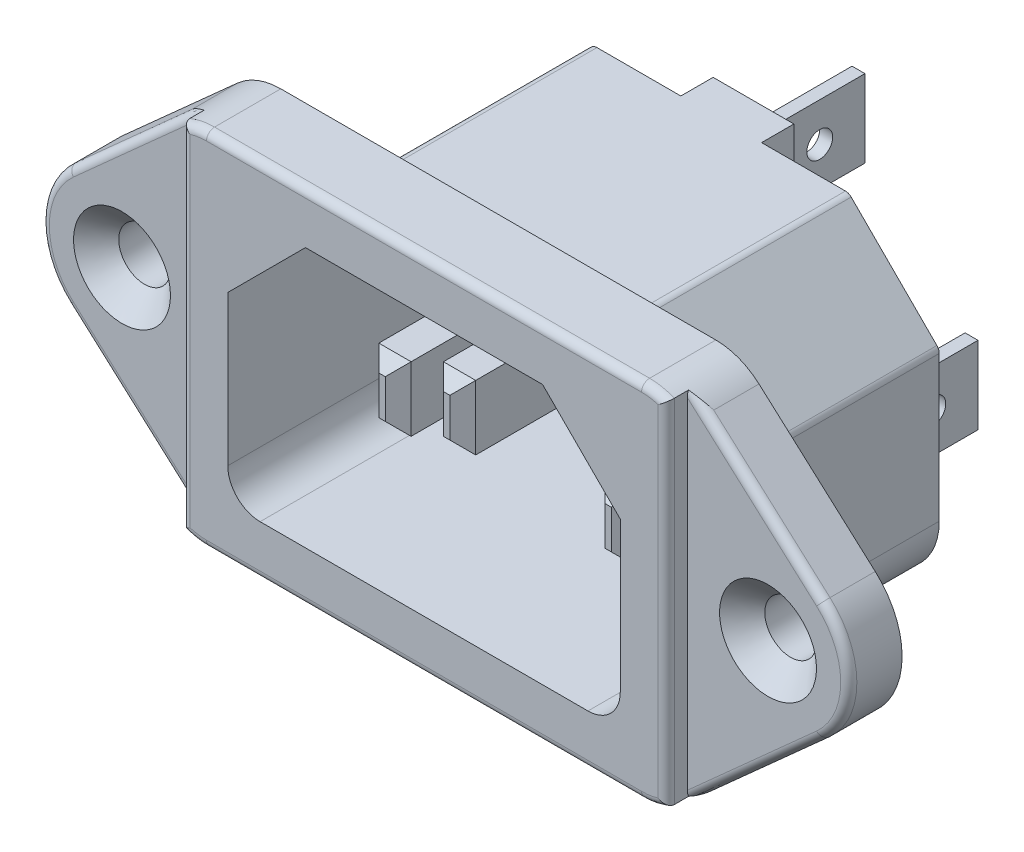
SolidWorks part; units mm, degrees
ref_plane "Front Plane" through (0, 0, 0) normal (0, 0, 1) x (1, 0, 0)
ref_plane "Top Plane" through (0, 0, 0) normal (0, 1, 0) x (1, 0, 0)
ref_plane "Right Plane" through (0, 0, 0) normal (1, 0, 0) x (0, 0, -1)
sketch "Sketch1" plane through (0, 0, 0) normal (0, 0, 1) x (1, 0, 0)
  line L0 (15, -11.2) -> (27.489, 0)
  line L1 (27.489, 0) -> (17.445, 11.2)
  line L2 (17.445, 11.2) -> (-15, 11.2)
  line L3 (-15, 11.2) -> (-27.489, 0)
  line L4 (-27.489, 0) -> (-15, -11.2)
  line L5 (-15, -11.2) -> (15, -11.2)
extrude "Boss-Extrude1" add sketch "Sketch1" against normal blind 3.3
sketch "Sketch2" plane through (0, 0, 0) normal (0, 0, 1) x (1, 0, 0)
  line L0 (15, -11.2) -> (-15, -11.2)
  line L1 (-15, -11.2) -> (-15, 11.2)
  line L2 (-15, 11.2) -> (15, 11.2)
  line L3 (15, 11.2) -> (15, -11.2)
extrude "Boss-Extrude2" add sketch "Sketch2" along normal blind 1.3
sketch "Sketch3" plane through (0, 0, -3.3) normal (0, 0, -1) x (-1, 0, 0)
  line L0 (7.9, 9.4) -> (13.5, 3.8)
  line L1 (13.5, 3.8) -> (13.5, -9.4)
  line L2 (13.5, -9.4) -> (-13.5, -9.4)
  line L3 (-13.5, -9.4) -> (-13.5, 3.8)
  line L4 (-13.5, 3.8) -> (-7.9, 9.4)
  line L5 (-7.9, 9.4) -> (7.9, 9.4)
extrude "Boss-Extrude3" add sketch "Sketch3" along normal blind 13.8
sketch "Sketch4" plane through (0, 0, 1.3) normal (0, 0, 1) x (1, 0, 0)
  line L0 (7.3408, 8.05) -> (-7.3408, 8.05)
  line L1 (-7.3408, 8.05) -> (-12.15, 3.2408)
  line L2 (-12.15, 3.2408) -> (-12.15, -8.05)
  line L3 (-12.15, -8.05) -> (12.15, -8.05)
  line L4 (12.15, -8.05) -> (12.15, 3.2408)
  line L5 (12.15, 3.2408) -> (7.3408, 8.05)
extrude "Cut-Extrude1" cut sketch "Sketch4" against normal blind 16.4
ref_plane "Plane1" through (0, 0, 0) normal (0, -1, 0) x (1, 0, 0)
sketch "Sketch5" plane through (0, 0, 0) normal (0, -1, 0) x (1, 0, 0)
  line L0 (-1, -15.1) -> (1, -15.1)
  line L1 (1, -15.1) -> (1, -0.9)
  line L2 (1, -0.9) -> (0, 0.1)
  line L3 (0, 0.1) -> (-1, -0.9)
  line L4 (-1, -0.9) -> (-1, -15.1)
extrude "Boss-Extrude4" add sketch "Sketch5" against normal blind 4 separate body
ref_plane "Plane2" through (0, -4, 0) normal (0, -1, 0) x (1, 0, 0)
sketch "Sketch6" plane through (0, -4, 0) normal (0, -1, 0) x (1, 0, 0)
  line L0 (-8, -15.1) -> (-6, -15.1)
  line L1 (-6, -15.1) -> (-6, -3.9)
  line L2 (-6, -3.9) -> (-7, -2.9)
  line L3 (-7, -2.9) -> (-8, -3.9)
  line L4 (-8, -3.9) -> (-8, -15.1)
extrude "Boss-Extrude5" add sketch "Sketch6" against normal blind 4 separate body
sketch "Sketch7" plane through (0, -4, 0) normal (0, -1, 0) x (1, 0, 0)
  line L0 (6, -15.1) -> (8, -15.1)
  line L1 (8, -15.1) -> (8, -3.9)
  line L2 (8, -3.9) -> (7, -2.9)
  line L3 (7, -2.9) -> (6, -3.9)
  line L4 (6, -3.9) -> (6, -15.1)
extrude "Boss-Extrude6" add sketch "Sketch7" against normal blind 4 separate body
sketch "Sketch8" plane through (0, 0, -17.1) normal (0, 0, -1) x (-1, 0, 0)
  line L0 (-2.5, 1.4) -> (-2.5, 9.4)
  line L1 (-2.5, 9.4) -> (2.5, 9.4)
  line L2 (2.5, 9.4) -> (2.5, 1.4)
  line L3 (2.5, 1.4) -> (-2.5, 1.4)
extrude "Boss-Extrude7" add sketch "Sketch8" along normal blind 2
sketch "Sketch9" plane through (0, 0, -19.1) normal (0, 0, -1) x (-1, 0, 0)
  line L0 (0.4, 3) -> (-0.4, 3)
  line L1 (-0.4, 3) -> (-0.4, 7.8)
  line L2 (-0.4, 7.8) -> (0.4, 7.8)
  line L3 (0.4, 7.8) -> (0.4, 3)
extrude "Boss-Extrude8" add sketch "Sketch9" along normal blind 6.5 separate body
sketch "Sketch10" plane through (0, 0, -17.1) normal (0, 0, -1) x (-1, 0, 0)
  line L0 (9.5, -1.4) -> (9.5, -9.4)
  line L1 (9.5, -9.4) -> (4.5, -9.4)
  line L2 (4.5, -9.4) -> (4.5, -1.4)
  line L3 (4.5, -1.4) -> (9.5, -1.4)
extrude "Boss-Extrude9" add sketch "Sketch10" along normal blind 2
sketch "Sketch11" plane through (0, 0, -19.1) normal (0, 0, -1) x (-1, 0, 0)
  line L0 (7.4, -7.8) -> (6.6, -7.8)
  line L1 (6.6, -7.8) -> (6.6, -3)
  line L2 (6.6, -3) -> (7.4, -3)
  line L3 (7.4, -3) -> (7.4, -7.8)
extrude "Boss-Extrude10" add sketch "Sketch11" along normal blind 6.5 separate body
sketch "Sketch12" plane through (0, 0, -17.1) normal (0, 0, -1) x (-1, 0, 0)
  line L0 (-4.5, -1.4) -> (-4.5, -9.4)
  line L1 (-4.5, -9.4) -> (-9.5, -9.4)
  line L2 (-9.5, -9.4) -> (-9.5, -1.4)
  line L3 (-9.5, -1.4) -> (-4.5, -1.4)
extrude "Boss-Extrude11" add sketch "Sketch12" along normal blind 2
sketch "Sketch13" plane through (0, 0, -19.1) normal (0, 0, -1) x (-1, 0, 0)
  line L0 (-6.6, -7.8) -> (-7.4, -7.8)
  line L1 (-7.4, -7.8) -> (-7.4, -3)
  line L2 (-7.4, -3) -> (-6.6, -3)
  line L3 (-6.6, -3) -> (-6.6, -7.8)
extrude "Boss-Extrude12" add sketch "Sketch13" along normal blind 6.5 separate body
draft "Draft1" type of draft neutral plane draft angle 6.229 faces to draft 1 parameters "D1"=6.229
hole_wizard "CSK for M3 Flat Head Machine Screw1" positions "Sketch15" profile "Sketch14" countersink size "M3" standard "ANSI Metric"
sketch "Sketch15" plane through (0, 0, 0) normal (0, 0, 1) x (1, 0, 0)
  point P0 (-20, 0)
  point P1 (20, 0)
sketch "Sketch14" plane through (-20, 0, 0) normal (1, 0, 0) x (0, -1, 0)
  line L0 (0, 0) -> (0, 25.6)
  line L1 (0, 25.6) -> (1.6, 25.6)
  line L2 (1.6, 25.6) -> (1.6, 1.4)
  line L3 (1.6, 1.4) -> (3, 0)
  line L5 (3, 0) -> (0, 0)
  line L6 (-1.6, 1.4) -> (-3, 0) construction
  line L11 (0, -6.35) -> (0, 107.95) construction
  dimension "Thru Hole Dia." = 3.2
  dimension "Thru Hole Depth" = 25.6
  dimension "Near C'Sink Dia." = 6
  dimension "Near C'Sink Angle" = 90
hole_wizard "Ø1.6 (1.6) Diameter Hole1" positions "Sketch17" profile "Sketch16" hole size "Ø1.6" standard "ANSI Metric"
sketch "Sketch17" plane through (7.4, 0, 0) normal (1, 0, 0) x (0, 0, -1)
  point P0 (22.8, -5.4)
sketch "Sketch16" plane through (7.4, -5.4, -22.8) normal (0, 1, 0) x (0, 0, -1)
  line L0 (0, 0) -> (0, 0.801)
  line L1 (0, 0.801) -> (0.8, 0.801)
  line L2 (0.8, 0.801) -> (0.8, 0)
  line L5 (0.8, 0) -> (0, 0)
  line L11 (0, -6.35) -> (0, 107.95) construction
  dimension "Thru Hole Dia." = 1.6
  dimension "Thru Hole Depth" = 0.801
hole_wizard "Ø1.6 (1.6) Diameter Hole2" positions "Sketch19" profile "Sketch18" hole size "Ø1.6" standard "ANSI Metric"
sketch "Sketch19" plane through (-6.6, 0, 0) normal (1, 0, 0) x (0, 0, -1)
  point P0 (22.8, -5.4)
sketch "Sketch18" plane through (-6.6, -5.4, -22.8) normal (0, 1, 0) x (0, 0, -1)
  line L0 (0, 0) -> (0, 20.889)
  line L1 (0, 20.889) -> (0.8, 20.889)
  line L2 (0.8, 20.889) -> (0.8, 0)
  line L5 (0.8, 0) -> (0, 0)
  line L11 (0, -6.35) -> (0, 107.95) construction
  dimension "Thru Hole Dia." = 1.6
  dimension "Thru Hole Depth" = 20.889
hole_wizard "Ø1.6 (1.6) Diameter Hole3" positions "Sketch21" profile "Sketch20" hole size "Ø1.6" standard "ANSI Metric"
sketch "Sketch21" plane through (-0.4, 0, 0) normal (-1, 0, 0) x (0, 0, 1)
  point P0 (-22.8, 5.4)
sketch "Sketch20" plane through (-0.4, 5.4, -22.8) normal (0, 1, 0) x (0, 0, 1)
  line L0 (0, 0) -> (0, 27.8891)
  line L1 (0, 27.8891) -> (0.8, 27.8891)
  line L2 (0.8, 27.8891) -> (0.8, 0)
  line L5 (0.8, 0) -> (0, 0)
  line L11 (0, -6.35) -> (0, 107.95) construction
  dimension "Thru Hole Dia." = 1.6
  dimension "Thru Hole Depth" = 27.8891
fillet "Fillet1" radius 4 6 edges at (-13.5, -9.4, -10.2) (13.5, -9.4, -10.2) (-15, 11.2, -1.65) (15, -11.2, -1.65) (-15, -11.2, -1.65)
fillet "Fillet2" radius 5 2 edges at (-27.489, 0, -1.65) (27.489, 0, -1.65)
chamfer "Chamfer1" distance 0.2828 angle 45 1 edges at (0, 2, 0.1)
fillet "Fillet3" radius 2 2 edges at (-12.15, -8.05, -6.9) (12.15, -8.05, -6.9)
fillet "Fillet4" radius 0.5 14 edges at (7.9, 9.4, -10.2) (-13.5, 3.8, -10.2) (0, 11.2, 1.3) (15, 0, 1.3) (-15, 0, 1.3) (0, -11.2, 1.3) (-7.9, 9.4, -10.2) (13.5, 3.8, -10.2) (-19.739, 6.9502, 0) (-25, 0, 0) (-19.739, -6.9502, 0) (19.739, -6.9502, 0) (25, 0, 0)
chamfer "Chamfer2" distance 0.8 angle 45 2 edges at (0, 4, -0.1) (0, 0, -0.1)
chamfer "Chamfer3" distance 0.2828 angle 45 1 edges at (-7, -2, -2.9)
chamfer "Chamfer4" distance 0.2828 angle 45 1 edges at (7, -2, -2.9)
chamfer "Chamfer5" distance 0.8 angle 45 2 edges at (-7, -4, -3.1) (-7, 0, -3.1)
chamfer "Chamfer6" distance 0.8 angle 45 2 edges at (7, -4, -3.1) (7, 0, -3.1)
